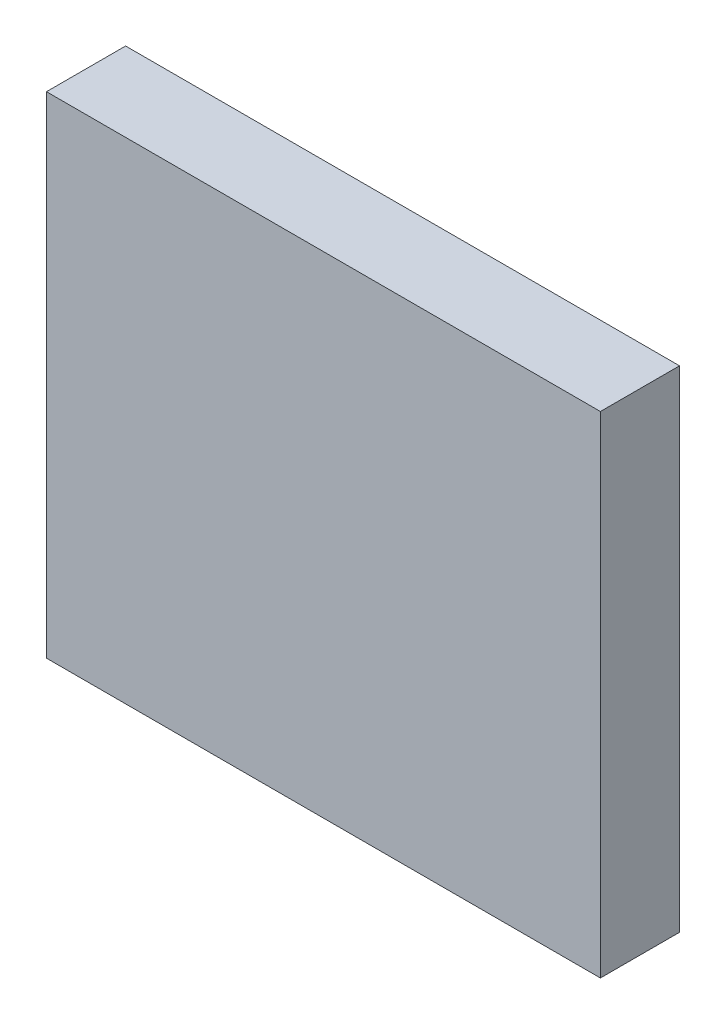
SolidWorks part; units mm, degrees
ref_plane "Ebene vorne" through (0, 0, 0) normal (0, 0, 1) x (1, 0, 0)
ref_plane "Ebene oben" through (0, 0, 0) normal (0, 1, 0) x (1, 0, 0)
ref_plane "Ebene rechts" through (0, 0, 0) normal (1, 0, 0) x (0, 0, -1)
sketch "Skizze1" plane through (0, 0, 0) normal (0, 0, 1) x (1, 0, 0)
  line L1 (0, 0) -> (35, 0)
  line L2 (0, 0) -> (0, 31)
  line L3 (0, 31) -> (35, 31)
  line L4 (35, 0) -> (35, 31)
  dimension "D1" = 31
  dimension "D2" = 35
extrude "Aufsatz-Linear austragen1" add sketch "Skizze1" along normal blind 5
